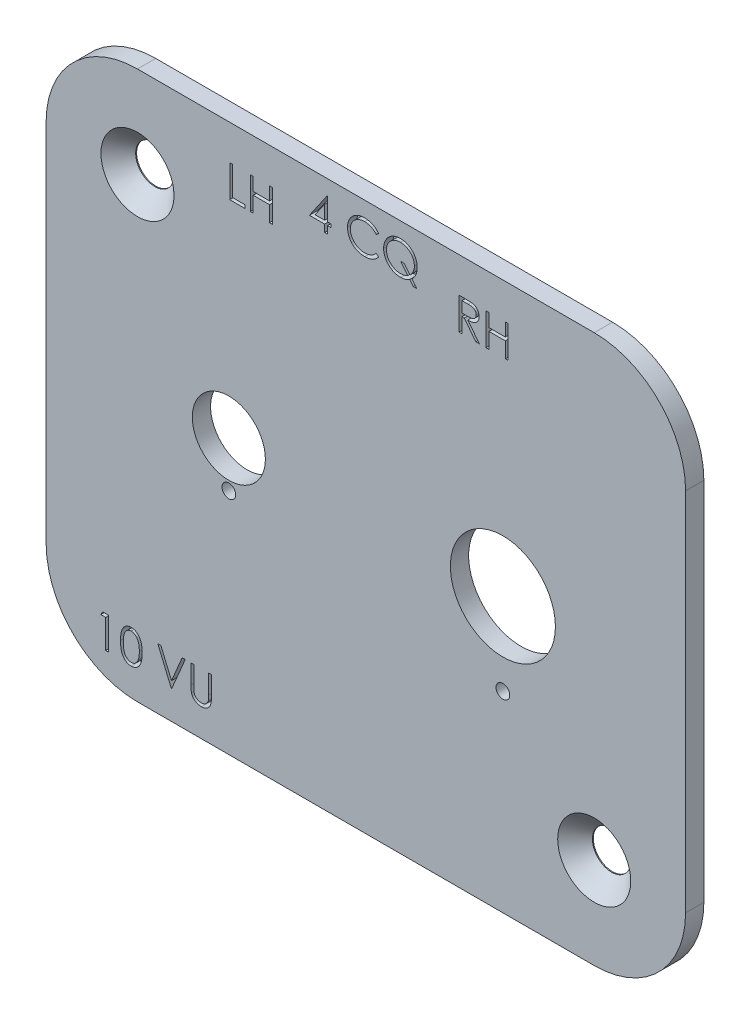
SolidWorks part; units mm, degrees
ref_plane "Plan de face" through (0, 0, 0) normal (0, 0, 1) x (1, 0, 0)
ref_plane "Plan de dessus" through (0, 0, 0) normal (0, 1, 0) x (1, 0, 0)
ref_plane "Plan de droite" through (0, 0, 0) normal (1, 0, 0) x (0, 0, -1)
sketch "Esquisse1" plane through (0, 0, 0) normal (0, 0, 1) x (1, 0, 0)
  line L1 (0, 0) -> (70, 0)
  line L2 (0, 0) -> (0, 60)
  line L3 (0, 60) -> (70, 60)
  line L4 (70, 0) -> (70, 60)
  dimension "D1" = 70
  dimension "D2" = 60
extrude "Boss.-Extru.1" add sketch "Esquisse1" against normal blind 2
fillet "Congé1" radius 10 4 edges at (70, 0, -1) (0, 0, -1) (0, 60, -1) (70, 60, -1)
sketch "Esquisse2" plane through (0, 0, 0) normal (0, 0, 1) x (1, 0, 0)
  line L0 (-9.6552, 50) -> (75.5928, 50) construction
  line L1 (-10.7481, 10) -> (82.5602, 10) construction
  line L2 (10, 73.7307) -> (10, -2.5007) construction
  line L3 (60, 73.7307) -> (60, -3.457) construction
  line L4 (60, 60) -> (10, 60) construction
  line L5 (0, 50) -> (0, 10) construction
  line L6 (10, 0) -> (60, 0) construction
  line L7 (70, 10) -> (70, 50) construction
  circle A0 centre (10, 50) radius 2.1
  circle A1 centre (60, 10) radius 2.1
  point P10 (0, 30)
  dimension "D5" = 4.2
  dimension "D6" = 4.2
  dimension "D1" = 10
  dimension "D2" = 10
  dimension "D3" = 10
  dimension "D4" = 10
extrude "Enlèv. mat.-Extru.1" cut sketch "Esquisse2" against normal through all
chamfer "Chanfrein1" distance 1.9 angle 45 2 edges at (62.1, 10, 0) (12.1, 50, 0)
sketch "Esquisse4" plane through (0, 0, 0) normal (0, 0, 1) x (1, 0, 0)
  text T0 "LH"
  text T1 "RH  "
  text T2 "4 CQ  "
  text T3 "10 VU"
extrude "Enlèv. mat.-Extru.4" cut sketch "Esquisse4" against normal blind 1
sketch "Esquisse5" plane through (0, 0, 0) normal (0, 0, 1) x (1, 0, 0)
  line L0 (10, 0) -> (60, 0) construction
  line L1 (0, 50) -> (0, 10) construction
  line L2 (70, 10) -> (70, 50) construction
  circle A0 centre (20, 30) radius 4
  circle A1 centre (50, 30) radius 5.75
  circle A2 centre (20, 25) radius 0.75
  circle A3 centre (50, 21) radius 0.75
  dimension "D1" = 8
  dimension "D2" = 11.5
  dimension "D7" = 1.5
  dimension "D10" = 9
  dimension "D11" = 1.5
  dimension "D3" = 20
  dimension "D4" = 20
  dimension "D5" = 30
  dimension "D6" = 30
  dimension "D8" = 5
  dimension "D9" = 20
  dimension "D12" = 20
extrude "Enlèv. mat.-Extru.5" cut sketch "Esquisse5" against normal through all
